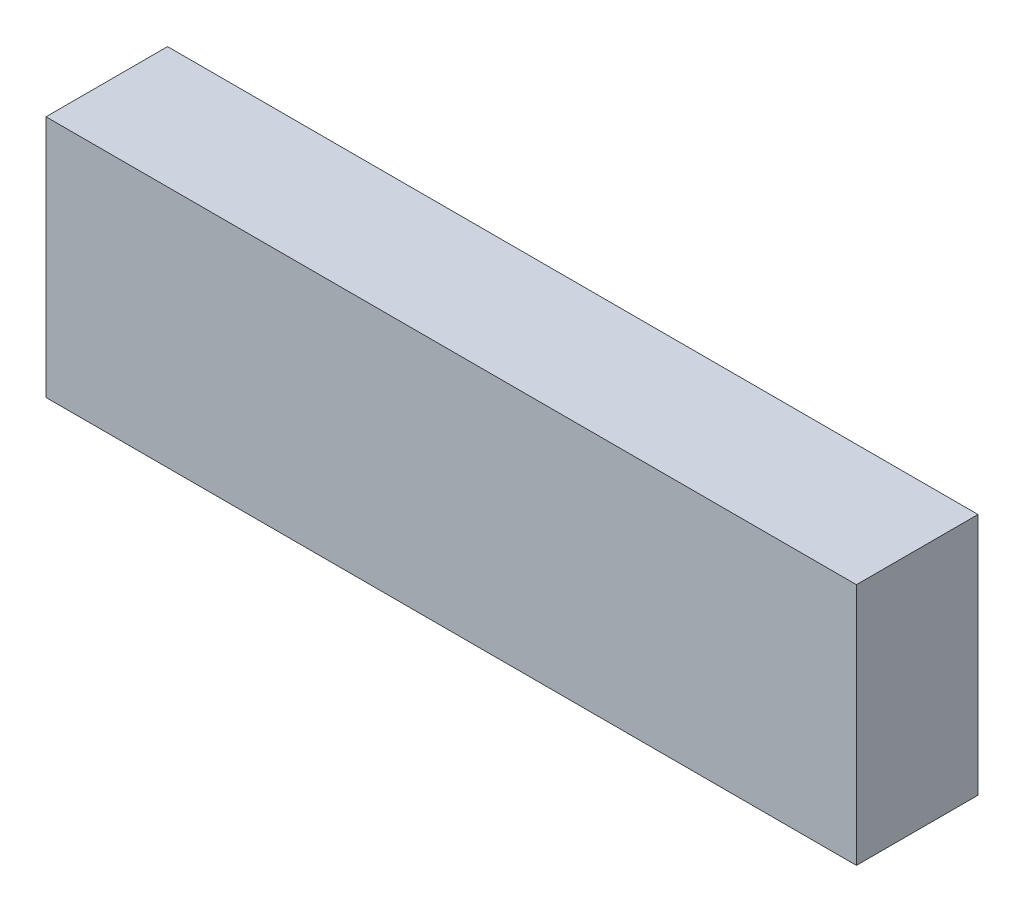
SolidWorks part; units mm, degrees
ref_plane "Front Plane" through (0, 0, 0) normal (0, 0, 1) x (1, 0, 0)
ref_plane "Top Plane" through (0, 0, 0) normal (0, 1, 0) x (1, 0, 0)
ref_plane "Right Plane" through (0, 0, 0) normal (1, 0, 0) x (0, 0, -1)
sketch "Sketch1" plane through (0, 0, 0) normal (0, 1, 0) x (1, 0, 0)
  line L1 (-127, -19.05) -> (127, -19.05)
  line L2 (-127, -19.05) -> (-127, 19.05)
  line L3 (-127, 19.05) -> (127, 19.05)
  line L4 (127, -19.05) -> (127, 19.05)
  line L5 (-127, -19.05) -> (127, 19.05) construction
  line L6 (-127, 19.05) -> (127, -19.05) construction
  point P0 (0, 0)
  dimension "D1" = 254
  dimension "D2" = 38.1
extrude "Boss-Extrude1" add sketch "Sketch1" along normal blind 76.2
